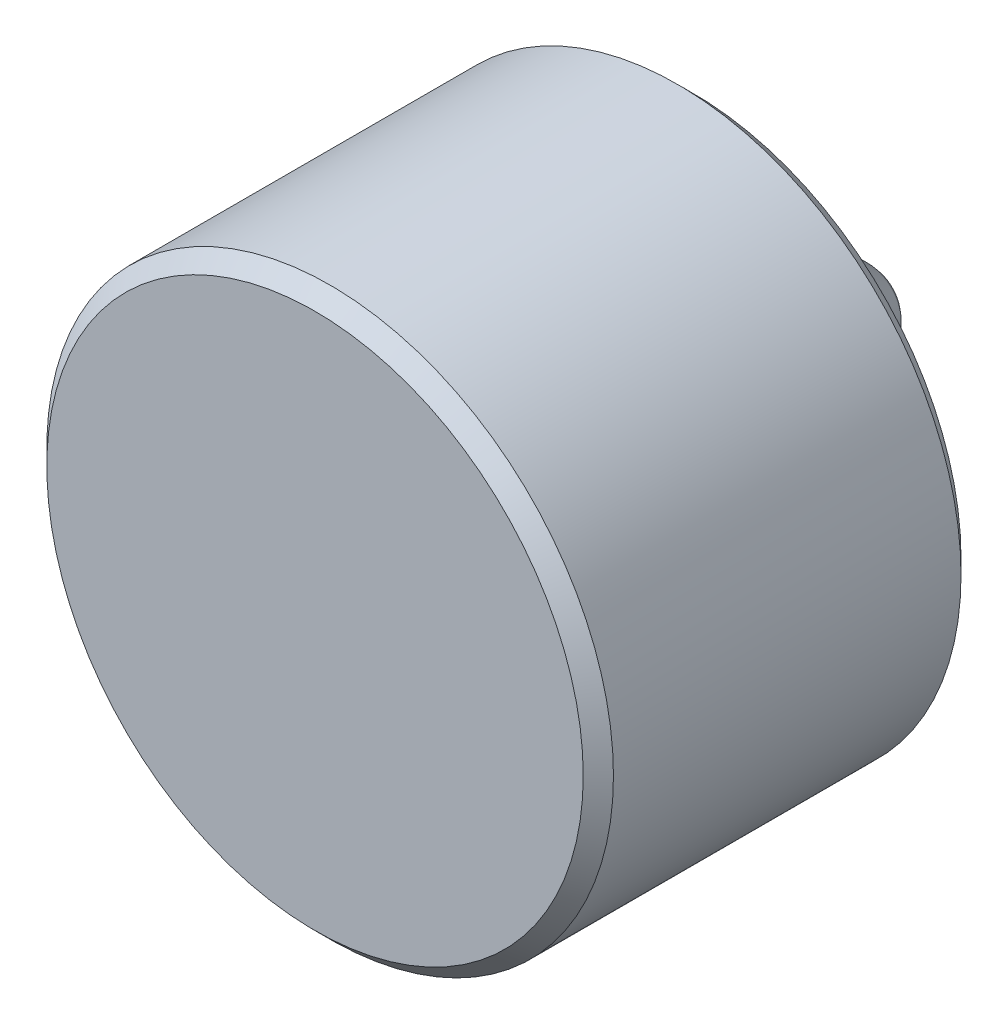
SolidWorks part; units mm, degrees
ref_plane "Спереди" through (0, 0, 0) normal (0, 0, 1) x (1, 0, 0)
ref_plane "Сверху" through (0, 0, 0) normal (0, 1, 0) x (1, 0, 0)
ref_plane "Справа" through (0, 0, 0) normal (1, 0, 0) x (0, 0, -1)
sketch "Эскиз1" plane through (0, 0, 0) normal (1, 0, 0) x (0, 0, -1)
  line L0 (0, 0) -> (27.1276, 0) construction
  line L1 (0, 0) -> (0, 4.5085)
  line L2 (0.254, 4.7625) -> (6.096, 4.7625)
  line L3 (6.35, 4.5085) -> (6.35, 3.5038)
  line L4 (6.35, 3.5038) -> (9.2925, 0.5613)
  line L5 (9.525, 0) -> (0, 0)
  line L6 (0, 4.5085) -> (0.254, 4.7625)
  line L7 (6.096, 4.7625) -> (6.35, 4.5085)
  arc A0 (9.2925, 0.5613) -> (9.525, 0) centre (8.7313, 0) cw
  point P4 (0, 4.7625)
  point P5 (6.35, 4.7625)
  dimension "D1" = 0.7937
  dimension "D2" = 9.525
  dimension "D3" = 45
  dimension "D4" = 3.175
  dimension "D5" = 9.525
revolve "Повернуть1" add sketch "Эскиз1" angle 360 about L0
